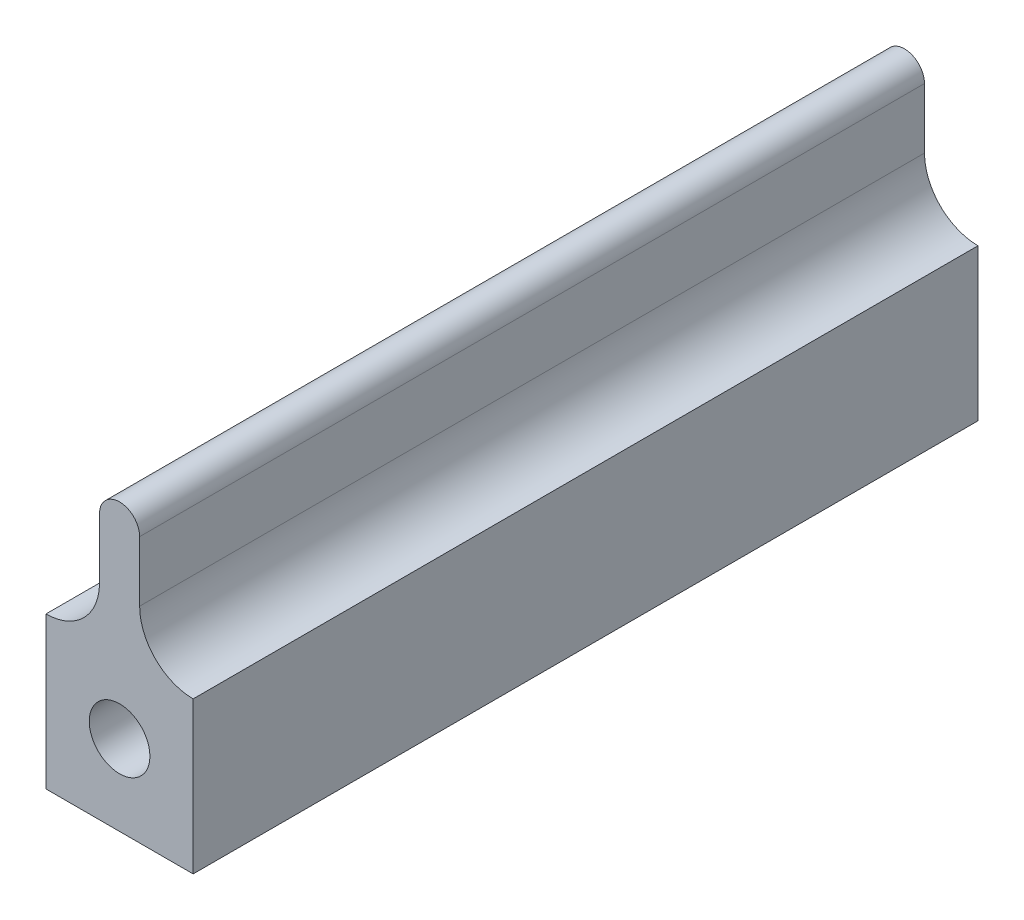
SolidWorks part; units mm, degrees
ref_plane "Frontal" through (0, 0, 0) normal (0, 0, 1) x (1, 0, 0)
ref_plane "Horizontal" through (0, 0, 0) normal (0, 1, 0) x (1, 0, 0)
ref_plane "Profil" through (0, 0, 0) normal (1, 0, 0) x (0, 0, -1)
sketch "Esquisse1" plane through (0, 0, 0) normal (0, 0, 1) x (1, 0, 0)
  line L0 (-135.75, -171.5) -> (-119.25, -171.5) construction
  line L1 (-119.25, -171.5) -> (-119.25, -154.5) construction
  line L2 (-125.25, -148.5) -> (-125.25, -141.75) construction
  line L3 (-129.75, -141.75) -> (-129.75, -148.5) construction
  line L4 (-135.75, -154.5) -> (-135.75, -171.5) construction
  line L5 (-135.75, -171.5) -> (-119.25, -171.5)
  line L6 (-119.25, -171.5) -> (-119.25, -154.5)
  line L7 (-125.25, -148.5) -> (-125.25, -141.75)
  line L8 (-129.75, -141.75) -> (-129.75, -148.5)
  line L9 (-135.75, -154.5) -> (-135.75, -171.5)
  arc A0 (-125.25, -148.5) -> (-119.25, -154.5) centre (-119.25, -148.5) ccw construction
  arc A1 (-125.25, -141.75) -> (-129.75, -141.75) centre (-127.5, -141.75) ccw construction
  arc A2 (-135.75, -154.5) -> (-129.75, -148.5) centre (-135.75, -148.5) ccw construction
  arc A3 (-125.25, -148.5) -> (-119.25, -154.5) centre (-119.25, -148.5) ccw
  arc A4 (-125.25, -141.75) -> (-129.75, -141.75) centre (-127.5, -141.75) ccw
  arc A5 (-135.75, -154.5) -> (-129.75, -148.5) centre (-135.75, -148.5) ccw
extrude "Base-Extrusion" add sketch "Esquisse1" against normal blind 88
hole_wizard "Trou taraudé M8x1.251" positions "Esquisse3" profile "Esquisse2" tap size "M8x1.25" standard "Ansi Métrique"
sketch "Esquisse3" plane through (0, 0, 0) normal (0, 0, 1) x (1, 0, 0)
  line L0 (-135.75, -171.5) -> (-119.25, -171.5) construction
  line L1 (-119.25, -171.5) -> (-119.25, -154.5) construction
  point P0 (-127.5, -162.5)
  dimension "D1" = 9
  dimension "D2" = 8.25
sketch "Esquisse2" plane through (-127.5, -162.5, 0) normal (1, 0, 0) x (0, -1, 0)
  line L0 (0, 0) -> (0, 32.0429)
  line L1 (0, 32.0429) -> (3.4, 30)
  line L2 (3.4, 30) -> (3.4, 0)
  line L5 (3.4, 0) -> (0, 0)
  line L10 (0, 32.0429) -> (-3.4, 30) construction
  line L11 (0, -6.35) -> (0, 107.95) construction
  dimension "Diamètre du perçage" = 6.8
  dimension "Profondeur du perçage" = 30
  dimension "Angle de pointe" = 118
